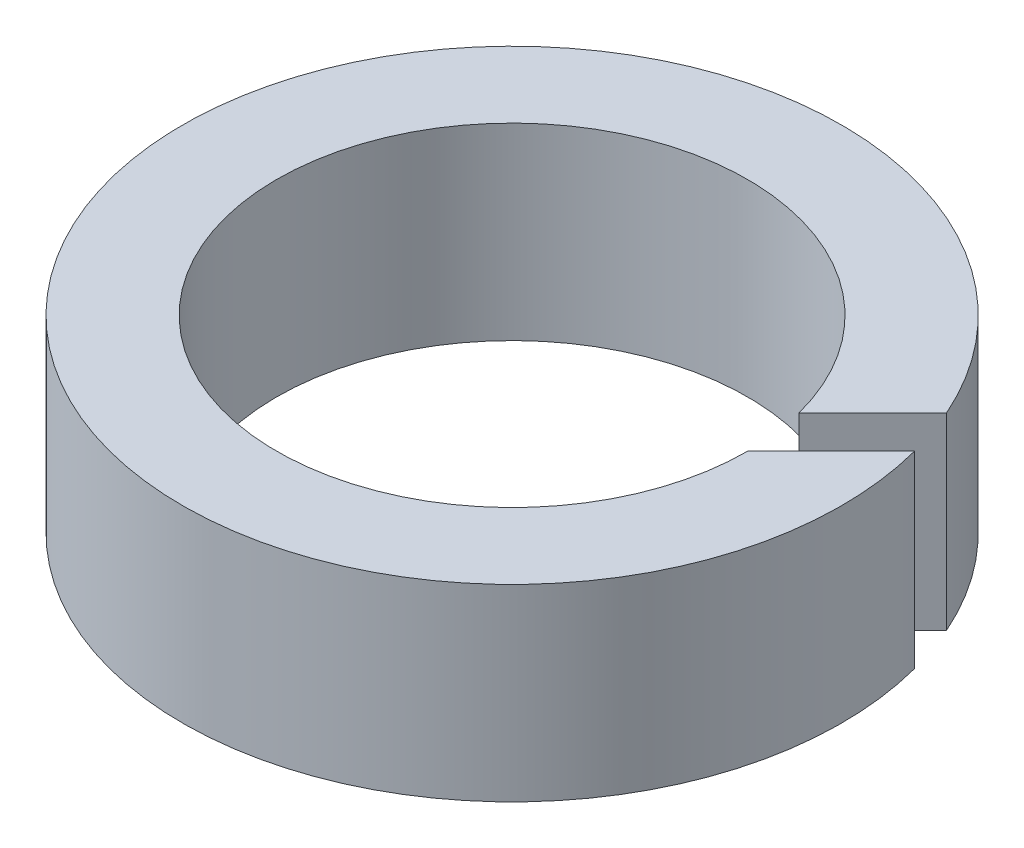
SolidWorks part; units mm, degrees
ref_plane "Front Plane" through (0, 0, 0) normal (0, 0, 1) x (1, 0, 0)
ref_plane "Top Plane" through (0, 0, 0) normal (0, 1, 0) x (1, 0, 0)
ref_plane "Right Plane" through (0, 0, 0) normal (1, 0, 0) x (0, 0, -1)
sketch "Sketch1"
  line L0 (5, 0) -> (6.772, 1.772)
  line L1 (4.8401, 1.2543) -> (6.4065, 2.8207)
  line L3 (4.2929, 0.7071) -> (7.4796, 3.8938) construction
  line L4 (5, 0) -> (8.1867, 3.1867) construction
  arc A0 (6.4065, 2.8207) -> (6.772, 1.772) centre (0, 0) ccw
  arc A1 (4.8401, 1.2543) -> (5, 0) centre (0, 0) ccw
other "AlignGroup1"
other "AlignGroup2"
other "AlignGroup3" parameters "D1"=51.2304, "D2"=13.6667, "D4"=7, "D5"=5, "D3"=45, "D6"=4.8401, "D7"=6.4065, "D8"=6.772
other "AlignGroup4"
extrude "Boss-Extrude1" add sketch "Sketch1" along normal blind 4
